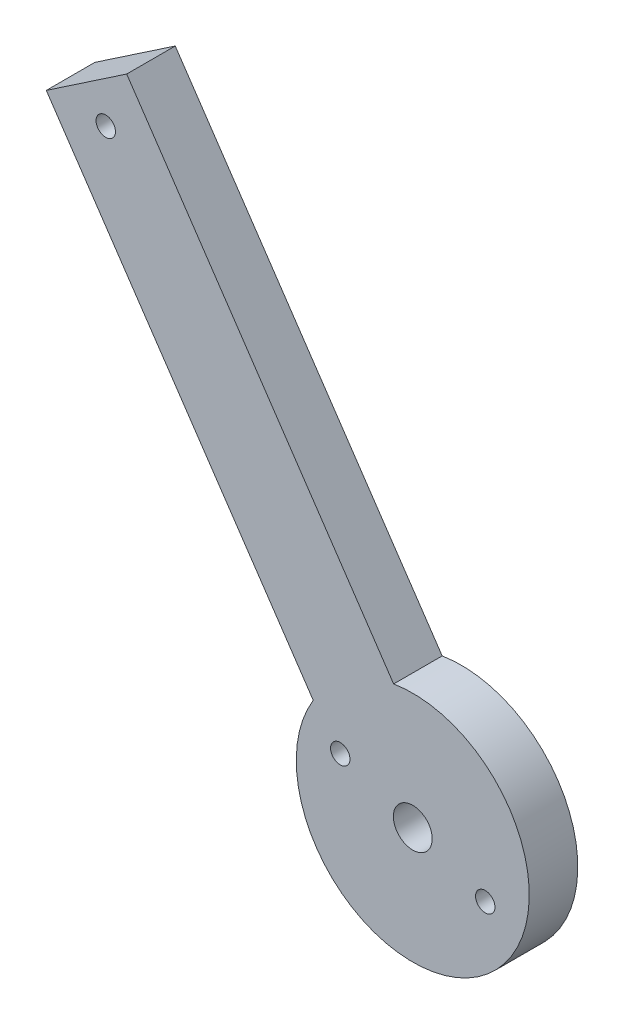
SolidWorks part; units mm, degrees
ref_plane "Front Plane" through (0, 0, 0) normal (0, 0, 1) x (1, 0, 0)
ref_plane "Top Plane" through (0, 0, 0) normal (0, 1, 0) x (1, 0, 0)
ref_plane "Right Plane" through (0, 0, 0) normal (1, 0, 0) x (0, 0, -1)
sketch "Sketch1" plane through (0, 0, 0) normal (0, 0, 1) x (1, 0, 0)
  line L0 (0, 0) -> (9.981, 0) construction
  line L1 (0, 0) -> (-5.0975, 7.538) construction
  line L3 (-10.2527, 6.2356) -> (-37.7525, 46.9015)
  line L4 (-37.7525, 46.9015) -> (-29.4687, 52.5033)
  line L5 (-29.4687, 52.5033) -> (-1.9689, 11.8374)
  arc A0 (-10.2527, 6.2356) -> (-1.9689, 11.8374) centre (0, 0) ccw
  dimension "D1" = 124.068
extrude "Boss-Extrude1" add sketch "Sketch1" along normal blind 5
sketch "Sketch2" plane through (0, 0, 5) normal (0, 0, 1) x (1, 0, 0)
  line L0 (0, 0) -> (-33.6106, 49.7024) construction
  line L1 (-29.4687, 52.5033) -> (-37.7525, 46.9015) construction
  circle A0 centre (0, 0) radius 2
  circle A1 centre (-31.6292, 46.7724) radius 1
  dimension "D1" = 56.463
extrude "Cut-Extrude1" cut sketch "Sketch2" against normal blind 5
sketch "Sketch3" plane through (0, 0, 5) normal (0, 0, 1) x (1, 0, 0)
  line L0 (0, 0) -> (10.4696, 0) construction
  line L1 (0, 0) -> (8.2903, -3.1823) construction
  line L2 (0, 0) -> (-8.8446, 3.3951) construction
  circle A0 centre (7.4686, -2.8669) radius 1
  circle A1 centre (-7.4686, 2.8669) radius 1
  circle A2 centre (0, 0) radius 2 construction
  dimension "D3" = 8
  dimension "D4" = 8
  dimension "D1" = 21
  dimension "D2" = 180
extrude "Cut-Extrude2" cut sketch "Sketch3" against normal blind 5
sketch "Sketch4" plane through (0, 0, 5) normal (0, 0, 1) x (1, 0, 0)
  line L0 (0, 0) -> (10.578, 0)
